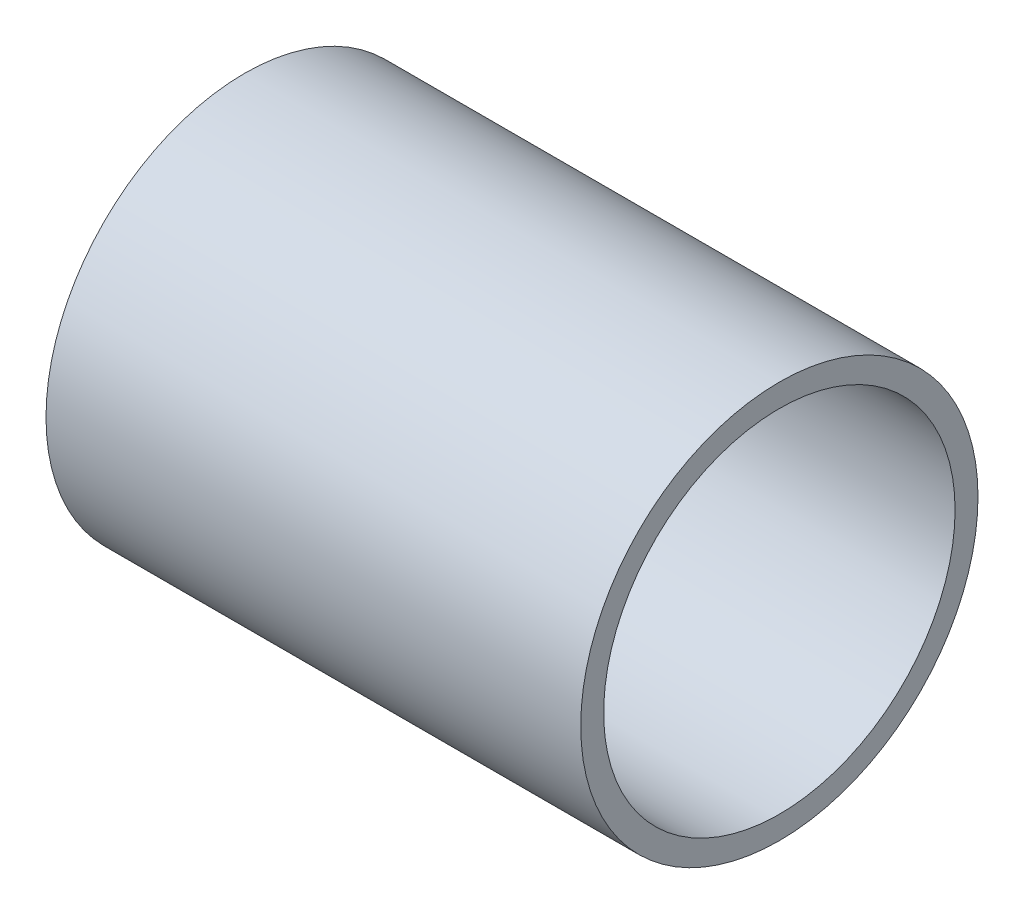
SolidWorks part; units mm, degrees
ref_plane "Front Plane" through (0, 0, 0) normal (0, 0, 1) x (1, 0, 0)
ref_plane "Top Plane" through (0, 0, 0) normal (0, 1, 0) x (1, 0, 0)
ref_plane "Right Plane" through (0, 0, 0) normal (1, 0, 0) x (0, 0, -1)
sketch "Sketch1" plane through (0, 0, 0) normal (1, 0, 0) x (0, 0, -1)
  circle A0 centre (0, 0) radius 26
  circle A1 centre (0, 0) radius 23
  dimension "D1" = 46
  dimension "D2" = 52
extrude "Extrude1" add sketch "Sketch1" along normal blind 70
